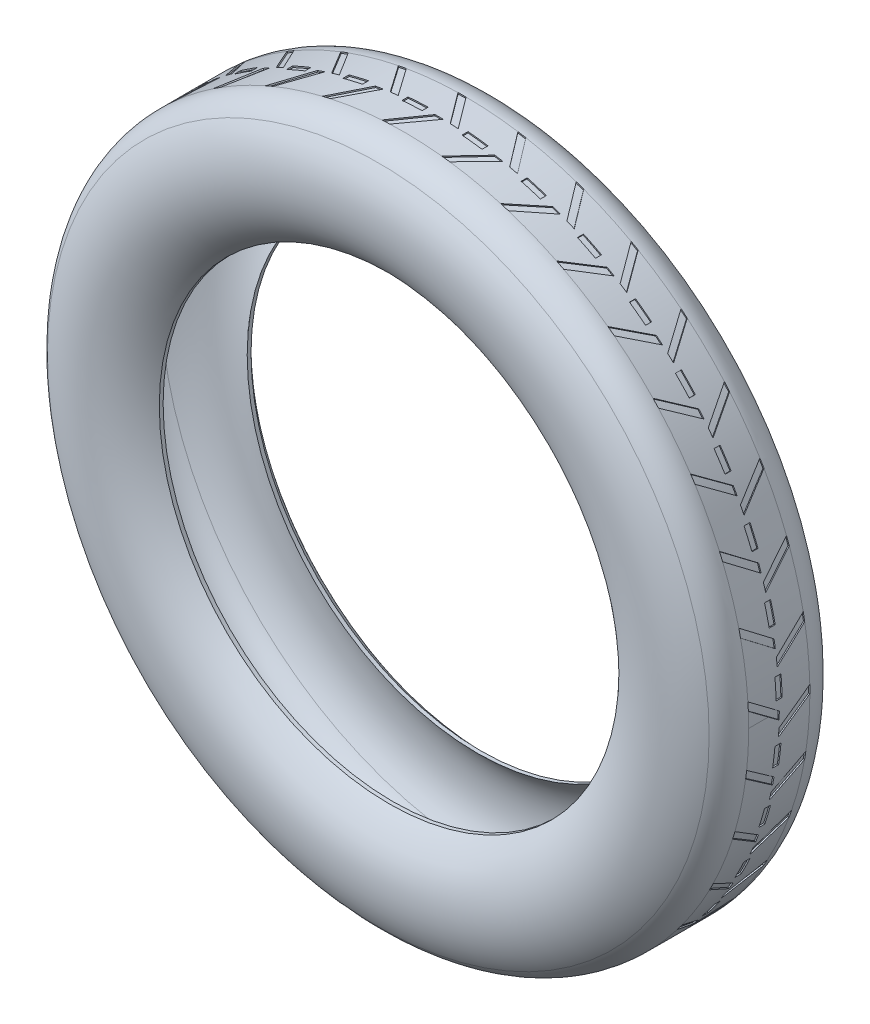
SolidWorks part; units mm, degrees
ref_plane "Front Plane" through (0, 0, 0) normal (0, 0, 1) x (1, 0, 0)
ref_plane "Top Plane" through (0, 0, 0) normal (0, 1, 0) x (1, 0, 0)
ref_plane "Right Plane" through (0, 0, 0) normal (1, 0, 0) x (0, 0, -1)
sketch "Sketch1" plane through (0, 0, 0) normal (1, 0, 0) x (0, 0, -1)
  line L0 (-159.8403, 0) -> (178.2533, 0) construction
  line L1 (0, 145.1491) -> (0, -154.1597) construction
  line L2 (-30.5, 343) -> (30.5, 343)
  line L3 (-5.2704, 285.3782) -> (56.5148, 329.6341) construction
  line L4 (5.2704, 285.3782) -> (-56.5148, 329.6341) construction
  line L5 (45.6953, 229) -> (-5.2704, 285.3782) construction
  line L6 (-45.6953, 229) -> (5.2704, 285.3782) construction
  line L7 (-45.6953, 229) -> (45.6953, 229)
  arc A0 (30.5, 343) -> (56.5148, 329.6341) centre (30.5, 311) cw
  arc A1 (-30.5, 343) -> (-56.5148, 329.6341) centre (-30.5, 311) ccw
  arc A2 (56.5148, 329.6341) -> (45.6953, 229) centre (-5.2704, 285.3782) cw
  arc A3 (-56.5148, 329.6341) -> (-45.6953, 229) centre (5.2704, 285.3782) ccw
  point P8 (0, 343)
  dimension "D3" = 32
  dimension "D4" = 76
  dimension "D1" = 61
  dimension "D2" = 686
  dimension "D5" = 83.5
  dimension "D6" = 458
revolve "Revolve1" add sketch "Sketch1" angle 360 about L0
shell "Shell1" thickness 2.5
ref_plane "Plane1" through (0, 360, 0) normal (0, 1, 0) x (1, 0, 0)
sketch "Sketch2" plane through (0, 360, 0) normal (0, 1, 0) x (1, 0, 0)
  line L0 (-437.6757, 0) -> (532.3532, 0) construction
  line L1 (52.3339, 30.5) -> (60.3339, 30.5)
  line L2 (30, 3) -> (50, 3)
  line L3 (30, 3) -> (30, -3)
  line L4 (30, -3) -> (50, -3)
  line L5 (50, 3) -> (50, -3)
  line L6 (52.3339, 30.5) -> (75, 0)
  line L7 (60.3339, 30.5) -> (83, 0)
  line L8 (75, 0) -> (83, 0)
  line L9 (343, 30.5) -> (-343, 30.5) construction
  line L10 (60, 0) -> (68, 0)
  line L11 (60, 0) -> (37.3339, -30.5)
  line L12 (68, 0) -> (45.3339, -30.5)
  line L13 (37.3339, -30.5) -> (45.3339, -30.5)
  line L14 (343, -30.5) -> (-343, -30.5) construction
  point P19 (67.9756, 1.7101)
  dimension "D1" = 8
  dimension "D2" = 38
  dimension "D3" = 75
  dimension "D4" = 8
  dimension "D5" = 38
  dimension "D6" = 60
  dimension "D7" = 6
  dimension "D8" = 3
  dimension "D9" = 30
  dimension "D10" = 20
wrap "Wrap1" sketch "Sketch2" wrap type deboss source sketch "Sketch2" thickness 1.25 parameters "D1"=1.25
pattern_circular "CirPattern1" count 36 over 360 about axis through (0, 0, 159.8403) along (0, 0, 1) of "Wrap1"
